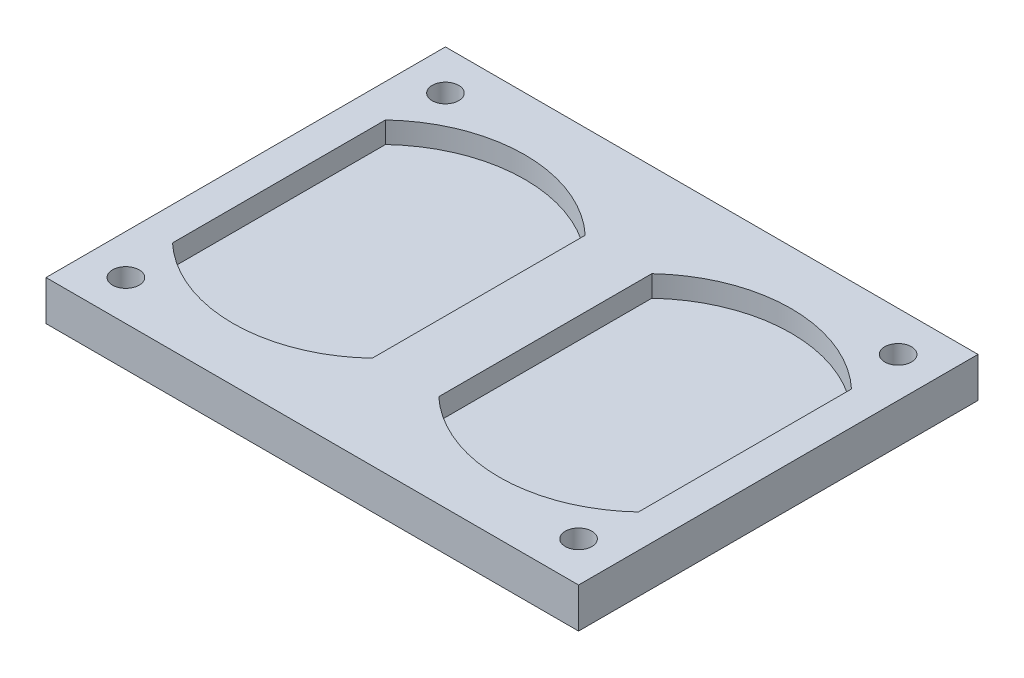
SolidWorks part; units mm, degrees
ref_plane "Front Plane" through (0, 0, 0) normal (0, 0, 1) x (1, 0, 0)
ref_plane "Top Plane" through (0, 0, 0) normal (0, 1, 0) x (1, 0, 0)
ref_plane "Right Plane" through (0, 0, 0) normal (1, 0, 0) x (0, 0, -1)
sketch "Sketch1" plane through (0, 0, 0) normal (0, 1, 0) x (1, 0, 0)
  line L1 (-100, -75) -> (100, -75)
  line L2 (-100, -75) -> (-100, 75)
  line L3 (-100, 75) -> (100, 75)
  line L4 (100, -75) -> (100, 75)
  line L5 (-100, -75) -> (100, 75) construction
  line L6 (-100, 75) -> (100, -75) construction
  point P0 (0, 0)
  dimension "D1" = 200
  dimension "D2" = 150
extrude "Boss-Extrude1" add sketch "Sketch1" along normal blind 15
sketch "Sketch2" plane through (0, 15, 0) normal (0, 1, 0) x (1, 0, 0)
  line L0 (0, -75) -> (0, 75) construction
  line L1 (-100, -75) -> (100, -75) construction
  line L2 (100, 75) -> (-100, 75) construction
  line L3 (0, 0) -> (-100, 0) construction
  line L4 (-100, 75) -> (-100, -75) construction
  line L5 (12.5, -40) -> (12.5, 40)
  line L7 (-87.5, -40) -> (-87.5, 40)
  line L9 (-12.5, -40) -> (-12.5, 40)
  line L10 (-87.5, -40) -> (-12.5, 40) construction
  line L11 (-87.5, 40) -> (-12.5, -40) construction
  line L12 (87.5, -40) -> (87.5, 40)
  arc A0 (-87.5, 40) -> (-12.5, 40) centre (-50, 0) cw
  arc A1 (-12.5, -40) -> (-87.5, -40) centre (-50, 0) cw
  arc A2 (12.5, -40) -> (87.5, -40) centre (50, 0) ccw
  arc A3 (87.5, 40) -> (12.5, 40) centre (50, 0) ccw
  point P10 (-50, 0)
  dimension "D1" = 80
  dimension "D2" = 75
extrude "Cut-Extrude1" cut sketch "Sketch2" against normal blind 8
hole_wizard "Ø10.0 (10) Diameter Hole1" positions "Sketch3" profile "Sketch4" hole size "Ø10.0" standard "ANSI Metric"
sketch "Sketch3" plane through (0, 15, 0) normal (0, 1, 0) x (1, 0, 0)
  line L0 (-100, -75) -> (100, -75) construction
  line L1 (100, 75) -> (-100, 75) construction
  line L2 (-100, 75) -> (-100, -75) construction
  line L3 (100, -75) -> (100, 75) construction
  point P0 (-85, 60)
  point P2 (85, 60)
  point P4 (85, -60)
  point P6 (-85, -60)
  dimension "D1" = 15
  dimension "D2" = 15
  dimension "D3" = 15
  dimension "D4" = 15
  dimension "D5" = 15
  dimension "D6" = 15
  dimension "D7" = 15
  dimension "D8" = 15
sketch "Sketch4" plane through (-85, 15, -60) normal (1, 0, 0) x (0, 0, 1)
  line L0 (0, 0) -> (0, 15)
  line L1 (0, 15) -> (5, 15)
  line L2 (5, 15) -> (5, 0)
  line L5 (5, 0) -> (0, 0)
  line L11 (0, -6.35) -> (0, 107.95) construction
  dimension "Thru Hole Dia." = 10
  dimension "Thru Hole Depth" = 15
